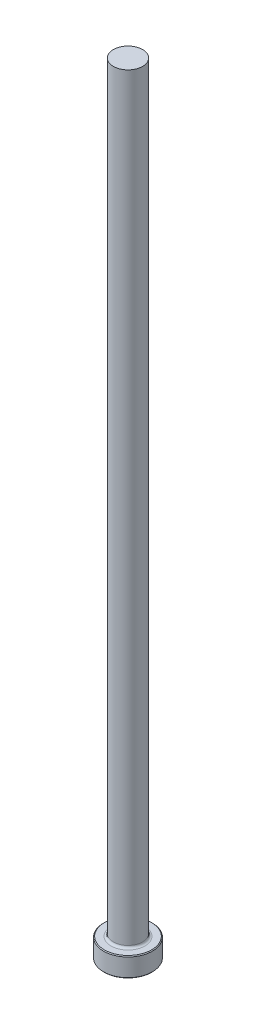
SolidWorks part; units mm, degrees
ref_plane "Front Plane" through (0, 0, 0) normal (0, 0, 1) x (1, 0, 0)
ref_plane "Top Plane" through (0, 0, 0) normal (0, 1, 0) x (1, 0, 0)
ref_plane "Right Plane" through (0, 0, 0) normal (1, 0, 0) x (0, 0, -1)
sketch "Sketch1" plane through (0, 0, 0) normal (0, 0, 1) x (1, 0, 0)
  line L0 (0, 259.9588) -> (0, -15.1925) construction
  line L1 (0, 0) -> (-7.9375, 0)
  line L2 (-7.9375, 0) -> (-7.9375, 6.35)
  line L3 (-7.9375, 6.35) -> (-4.7625, 6.35)
  line L4 (-4.7625, 6.35) -> (-4.7625, 254)
  line L5 (-4.7625, 254) -> (0, 254)
  line L6 (0, 254) -> (0, 0)
  dimension "L" = 254
  dimension "H" = 15.875
  dimension "T" = 6.35
  dimension "D" = 9.525
revolve "Revolve1" add sketch "Sketch1" angle 360 about L0
chamfer "Chamfer1" distance 0.254 angle 45 2 edges at (0, 6.35, 7.9375) (0, 0, 7.9375)
fillet "Fillet1" radius 0.762 1 edges at (0, 6.35, 4.7625)
sketch "Pocket Sketch" plane through (0, 0, 0) normal (0, 0, 1) x (1, 0, 0)
  line L0 (-8.3344, 0) -> (-8.3344, 6.3754)
  line L1 (-8.3344, 6.3754) -> (-5.9214, 6.3754)
  line L2 (-5.1594, 7.1374) -> (-5.1594, 22.225)
  line L3 (-5.1594, 22.225) -> (0, 22.225)
  line L4 (0, 22.225) -> (0, 0)
  line L5 (0, 0) -> (-8.3344, 0)
  line L6 (0, 12.6104) -> (0, -2.4989) construction
  line L7 (-7.9375, 6.096) -> (-7.9375, 0.254) construction
  line L8 (7.6835, 6.35) -> (-7.6835, 6.35) construction
  line L9 (-4.7625, 254) -> (-4.7625, 7.112) construction
  line L10 (-5.9214, 6.3754) -> (-5.1594, 7.1374)
  point P3 (-5.1594, 6.3754)
  dimension "D1" = 16.6687
  dimension "D2" = 0.3969
  dimension "D3" = 0.0254
  dimension "D4" = 0.3969
  dimension "D5" = 10.3187
  dimension "D6" = 22.225
